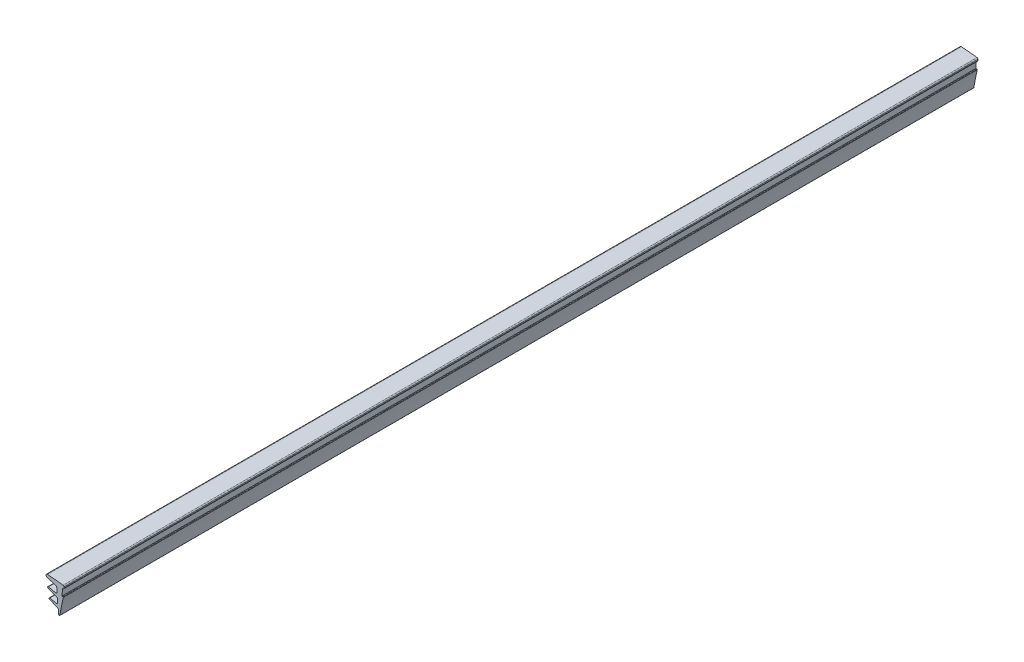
SolidWorks part; units mm, degrees
ref_plane "前视基准面" through (0, 0, 0) normal (0, 0, 1) x (1, 0, 0)
ref_plane "上视基准面" through (0, 0, 0) normal (0, 1, 0) x (1, 0, 0)
ref_plane "右视基准面" through (0, 0, 0) normal (1, 0, 0) x (0, 0, -1)
sketch "草图1" plane through (0, 0, 0) normal (0, 0, 1) x (1, 0, 0)
  line L0 (2.6761, 2.3354) -> (2.6931, 2.6731)
  line L1 (2.3777, 3.0391) -> (-2.7404, 3.5409)
  line L2 (-2.9246, 2.6655) -> (0.1169, 1.6679)
  line L3 (0.2882, 1.4497) -> (0.3988, 0.0311)
  line L4 (-0.0961, -0.3883) -> (-2.3862, 0.1785)
  line L5 (-2.539, -0.2963) -> (0.2358, -1.4044)
  line L6 (0.5385, -1.7616) -> (0.6226, -2.8415)
  line L7 (0.1277, -3.2609) -> (-1.921, -2.7538)
  line L8 (-2.0759, -3.2278) -> (0.5158, -4.2909)
  line L9 (0.8184, -4.6481) -> (0.9263, -6.0323)
  line L10 (2.3658, -0.2827) -> (2.1665, -0.2867)
  line L11 (2.0645, -0.1833) -> (2.1302, 1.7631)
  line L12 (2.3452, 2.0022) -> (2.3754, 2.0065)
  arc A0 (2.3754, 2.0065) -> (2.6761, 2.3354) centre (2.3265, 2.353) ccw
  arc A1 (2.6931, 2.6731) -> (2.3777, 3.0391) centre (2.3435, 2.6907) ccw
  arc A2 (-2.7404, 3.5409) -> (-2.9246, 2.6655) centre (-2.7843, 3.0931) ccw
  arc A3 (0.2882, 1.4497) -> (0.1169, 1.6679) centre (0.039, 1.4303) ccw
  arc A4 (-0.0961, -0.3883) -> (0.3988, 0.0311) centre (0, 0) ccw
  arc A5 (-2.3862, 0.1785) -> (-2.539, -0.2963) centre (-2.4462, -0.0641) ccw
  arc A6 (0.5385, -1.7616) -> (0.2358, -1.4044) centre (0.1397, -1.7927) ccw
  arc A7 (0.1277, -3.2609) -> (0.6226, -2.8415) centre (0.2238, -2.8726) ccw
  arc A8 (-1.921, -2.7538) -> (-2.0759, -3.2278) centre (-1.981, -2.9965) ccw
  arc A9 (0.8184, -4.6481) -> (0.5158, -4.2909) centre (0.4196, -4.6792) ccw
  arc A10 (0.9263, -6.0323) -> (1.3062, -6.1029) centre (1.1257, -6.0167) ccw
  arc A11 (2.4675, -0.3898) -> (1.3062, -6.1029) centre (118.3339, -26.9163) ccw
  arc A12 (2.4675, -0.3898) -> (2.3658, -0.2827) centre (2.3677, -0.3827) ccw
  arc A13 (2.0645, -0.1833) -> (2.1665, -0.2867) centre (2.1645, -0.1867) ccw
  arc A14 (2.3452, 2.0022) -> (2.1302, 1.7631) centre (2.3801, 1.7546) ccw
sketch "草图2" plane through (0, 0, 0) normal (0, 1, 0) x (1, 0, 0)
  line L0 (0, 0) -> (0, 300)
  dimension "D1" = 300
sweep "扫描1" add profiles "草图1" path "草图2"
